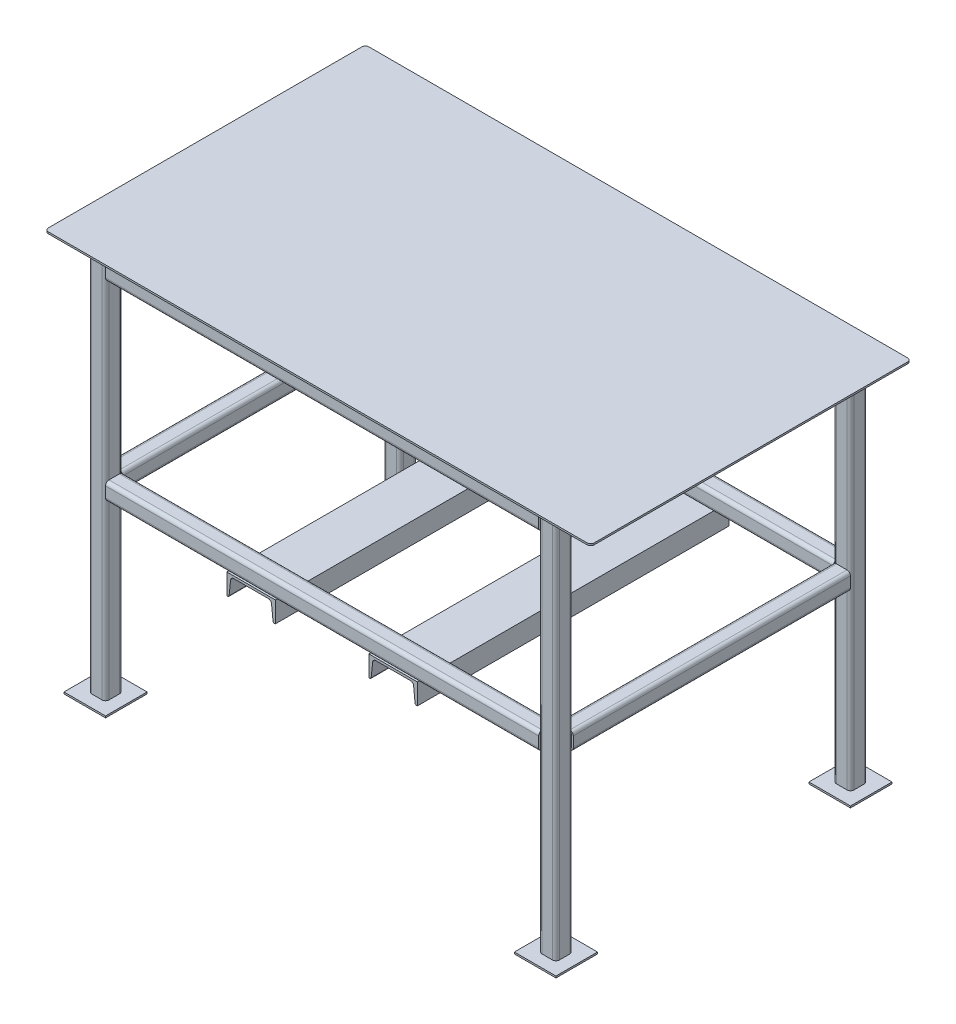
SolidWorks part; units mm, degrees
ref_plane "Default Plane" through (787.5, 1105, 452.5) normal (0, -1, 0) x (-1, 0, 0)
sketch3d "Bounding-Box_PLATE, 5 x 925 x 1575<1>"
  line L0 (0, 915, 0) -> (1575, 915, 0) construction
  line L1 (1575, 915, 0) -> (1575, -10, 0) construction
  line L2 (1575, -10, 0) -> (0, -10, 0) construction
  line L3 (0, -10, 0) -> (0, 915, 0) construction
  line L4 (0, 915, 5) -> (1575, 915, 5) construction
  line L5 (1575, 915, 5) -> (1575, -10, 5) construction
  line L6 (1575, -10, 5) -> (0, -10, 5) construction
  line L7 (0, -10, 5) -> (0, 915, 5) construction
  line L8 (0, 915, 0) -> (0, 915, 5) construction
  line L9 (1575, 915, 0) -> (1575, 915, 5) construction
  line L10 (1575, -10, 0) -> (1575, -10, 5) construction
  line L11 (0, -10, 0) -> (0, -10, 5) construction
ref_plane "Default Plane" through (710, 0, -365) normal (0, -1, 0) x (-1, 0, 0)
sketch3d "Bounding-Box_PLATE, 5 x 120 x 120<1>"
  line L0 (120, 0, 0) -> (120, 120, 0) construction
  line L1 (120, 120, 0) -> (0, 120, 0) construction
  line L2 (0, 120, 0) -> (0, 0, 0) construction
  line L3 (0, 0, 0) -> (120, 0, 0) construction
  line L4 (120, 0, 5) -> (120, 120, 5) construction
  line L5 (120, 120, 5) -> (0, 120, 5) construction
  line L6 (0, 120, 5) -> (0, 0, 5) construction
  line L7 (0, 0, 5) -> (120, 0, 5) construction
  line L8 (120, 0, 0) -> (120, 0, 5) construction
  line L9 (120, 120, 0) -> (120, 120, 5) construction
  line L10 (0, 120, 0) -> (0, 120, 5) construction
  line L11 (0, 0, 0) -> (0, 0, 5) construction
ref_plane "Front Plane" through (0, 0, 0) normal (0, 0, 1) x (1, 0, 0)
ref_plane "Top Plane" through (0, 0, 0) normal (0, 1, 0) x (1, 0, 0)
ref_plane "Right Plane" through (0, 0, 0) normal (1, 0, 0) x (0, 0, -1)
sketch3d "Frame Layout"
  line L0 (-650, 0, 425) -> (-650, 1100, 425)
  line L1 (-650, 0, 425) -> (-650, 0, -425) construction
  line L2 (-650, 0, 425) -> (650, 0, 425) construction
  line L3 (650, 0, 425) -> (650, 0, -425) construction
  line L4 (-650, 0, -425) -> (650, 0, -425) construction
  line L5 (-650, 0, 425) -> (650, 0, -425) construction
  line L6 (650, 0, 425) -> (-650, 0, -425) construction
  line L7 (-650, 0, -425) -> (-650, 1100, -425)
  line L8 (650, 0, 425) -> (650, 1100, 425)
  line L9 (650, 0, -425) -> (650, 1100, -425)
  line L10 (0, 1100, -425) -> (0, 1100, 425)
  line L11 (-650, 1100, 425) -> (-650, 1100, -425)
  line L12 (-650, 1100, 425) -> (650, 1100, 425)
  line L13 (650, 1100, 425) -> (650, 1100, -425)
  line L14 (-650, 1100, -425) -> (650, 1100, -425)
  line L15 (-650, 550, 425) -> (-650, 550, -425)
  line L16 (-650, 550, -425) -> (650, 550, -425)
  line L17 (650, 550, -425) -> (650, 550, 425)
  line L18 (650, 550, 425) -> (-650, 550, 425)
  point P0 (0, 0, 0)
  dimension "D1" = 1300
  dimension "D2" = 850
  dimension "D3" = 1100
other "Tube (square) 50 X 50 X 5.0(1)"
ref_plane "Plane1" through (-650, 0, 425) normal (0, 1, 0) x (1, 0, 0)
sketch "Sketch1" plane through (-650, 0, 425) normal (0, 1, 0) x (1, 0, 0)
  line L0 (-15, -20) -> (15, -20)
  line L1 (-20, -15) -> (-20, 15)
  line L2 (15, 20) -> (-15, 20)
  line L3 (20, 15) -> (20, -15)
  line L4 (-15, -25) -> (15, -25)
  line L5 (-25, -15) -> (-25, 15)
  line L6 (15, 25) -> (-15, 25)
  line L7 (25, 15) -> (25, -15)
  line L8 (-25, 0) -> (-20, 0) construction
  line L9 (-20, 0) -> (20, 0) construction
  line L10 (20, 0) -> (25, 0) construction
  line L12 (0, 25) -> (0, 20) construction
  line L13 (0, 20) -> (0, -20) construction
  line L14 (0, -20) -> (0, -25) construction
  arc A0 (25, 15) -> (15, 25) centre (15, 15) ccw
  arc A1 (15, -25) -> (25, -15) centre (15, -15) ccw
  arc A2 (-25, -15) -> (-15, -25) centre (-15, -15) ccw
  arc A3 (-15, 25) -> (-25, 15) centre (-15, 15) ccw
  arc A4 (-15, 20) -> (-20, 15) centre (-15, 15) ccw
  arc A5 (20, 15) -> (15, 20) centre (15, 15) ccw
  arc A6 (15, -20) -> (20, -15) centre (15, -15) ccw
  arc A7 (-20, -15) -> (-15, -20) centre (-15, -15) ccw
  point P2 (-25, 25)
  point P33 (-25, -25)
  point P34 (25, -25)
  point P36 (25, 25)
  point P37 (0, 0)
  dimension "D1" = 10
  dimension "Thickness" = 5
  dimension "V_leg" = 50
  dimension "H_leg" = 50
sketch "Sketch2" plane through (0, 1100, 0) normal (0, 1, 0) x (1, 0, 0)
  line L1 (787.5, 462.5) -> (-787.5, 462.5)
  line L2 (787.5, 462.5) -> (787.5, -462.5)
  line L3 (787.5, -462.5) -> (-787.5, -462.5)
  line L4 (-787.5, 462.5) -> (-787.5, -462.5)
  line L5 (787.5, 462.5) -> (-787.5, -462.5) construction
  line L6 (787.5, -462.5) -> (-787.5, 462.5) construction
  point P0 (0, 0)
  dimension "D1" = 1575
  dimension "D2" = 925
extrude "Top Plate" add sketch "Sketch2" along normal blind 5 separate body
sketch "Sketch3" plane through (0, 0, 0) normal (0, -1, 0) x (1, 0, 0)
  line L0 (-665, 450) -> (-635, 450) construction
  line L1 (-710, 485) -> (-590, 485)
  line L2 (-710, 485) -> (-710, 365)
  line L3 (-710, 365) -> (-590, 365)
  line L4 (-590, 485) -> (-590, 365)
  line L5 (-650, 365) -> (-650, 485) construction
  line L6 (-710, 425) -> (-590, 425) construction
  line L7 (-625, 440) -> (-625, 410) construction
  point P0 (-650, 425)
  point P6 (-650, 450)
  point P9 (-625, 425)
  dimension "D1" = 120
extrude "Base Plate" add sketch "Sketch3" along normal blind 5 separate body
mirror "Mirror1" about plane through (0, 0, 0) normal (0, 0, 1)
mirror "Mirror2" about plane through (0, 0, 0) normal (1, 0, 0)
fillet "Fillet1" radius 10 4 edges at (-787.5, 1102.5, -462.5) (787.5, 1102.5, -462.5) (787.5, 1102.5, 462.5) (-787.5, 1102.5, 462.5)
sketch "Channel Layout" plane through (0, 500, 0) normal (0, -1, 0) x (1, 0, 0)
  line L0 (0, -450) -> (0, 450) construction
  line L1 (625, 450) -> (-625, 450) construction
  line L2 (-205, 450) -> (-205, -450)
  line L3 (625, -450) -> (-625, -450) construction
  line L4 (205, 450) -> (205, -450)
  point P4 (0, 0)
  dimension "D1" = 410
other "C channel CH 140 X 15(1)"
ref_plane "Plane2" through (-135, 500, 450) normal (0, 0, -1) x (0, -1, 0)
sketch "Sketch11" plane through (-135, 500, 450) normal (0, 0, -1) x (0, -1, 0)
  line L0 (60, 140) -> (0, 140)
  line L1 (60, 0) -> (0, 0)
  line L2 (0, 140) -> (0, 0)
  line L5 (0, 9) -> (30.8145, 9) construction
  line L6 (60, 140) -> (60, 137.8528)
  line L7 (60, 0) -> (60, 2.1472)
  line L12 (6.7, 120.0953) -> (6.7, 19.9047)
  line L17 (14.7592, 129.046) -> (55.9704, 133.3775)
  line L18 (14.7592, 10.954) -> (55.9704, 6.6225)
  arc A0 (55.9704, 133.3775) -> (60, 137.8528) centre (55.5, 137.8528) ccw
  arc A1 (55.9704, 6.6225) -> (60, 2.1472) centre (55.5, 2.1472) cw
  arc A9 (6.7, 19.9047) -> (14.7592, 10.954) centre (15.7, 19.9047) ccw
  arc A10 (6.7, 120.0953) -> (14.7592, 129.046) centre (15.7, 120.0953) cw
  point P10 (30, 140)
  point P11 (30, 0)
  point P12 (6.7, 70)
  point P13 (0, 70)
  point P14 (0, 0)
  dimension "RI" = 9
  dimension "D2" = 6
  dimension "RA" = 4.5
  dimension "D3" = 19.9047
  dimension "Depth" = 140
  dimension "BF" = 60
  dimension "TW" = 6.7
  dimension "TF" = 9
  dimension "d1" = 100.1907
